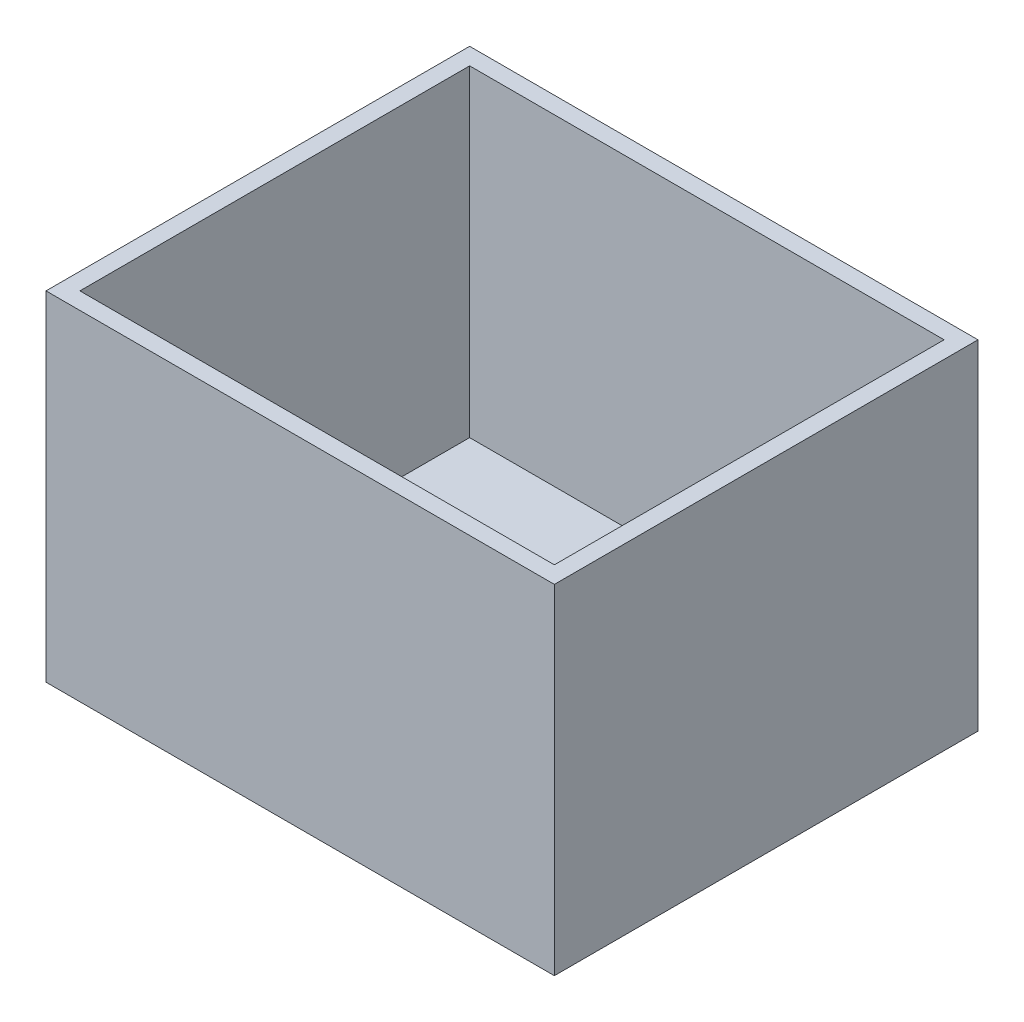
SolidWorks part; units mm, degrees
ref_plane "Plan de face" through (0, 0, 0) normal (0, 0, 1) x (1, 0, 0)
ref_plane "Plan de dessus" through (0, 0, 0) normal (0, 1, 0) x (1, 0, 0)
ref_plane "Plan de droite" through (0, 0, 0) normal (1, 0, 0) x (0, 0, -1)
sketch "Esquisse1" plane through (0, 0, 0) normal (0, 0, 1) x (1, 0, 0)
  line L1 (0, 0) -> (60, 0)
  line L2 (0, 0) -> (0, 40)
  line L3 (0, 40) -> (60, 40)
  line L4 (60, 0) -> (60, 40)
  dimension "D1" = 40
  dimension "D2" = 60
extrude "Boss.-Extru.1" add sketch "Esquisse1" along normal mid plane 50
sketch "Esquisse2" plane through (0, 0, 0) normal (0, -1, 0) x (1, 0, 0)
  line L0 (0, 0) -> (55, 0) construction
  line L1 (0, 25) -> (0, -25) construction
  circle A0 centre (6, 18) radius 2.5
  circle A1 centre (6, -18) radius 2.5
  circle A2 centre (55, 0) radius 2.5
  dimension "D1" = 5
  dimension "D2" = 18
  dimension "D3" = 36
  dimension "D4" = 6
  dimension "D5" = 55
sketch "Esquisse3" plane through (0, 40, 0) normal (0, 1, 0) x (1, 0, 0)
  line L0 (58, 23) -> (2, 23)
  line L1 (2, 23) -> (2, -23)
  line L2 (2, -23) -> (58, -23)
  line L3 (58, -23) -> (58, 23)
  line L4 (60, 25) -> (0, 25)
  line L5 (0, 25) -> (0, -25)
  line L6 (0, -25) -> (60, -25)
  line L7 (60, -25) -> (60, 25)
  line L8 (60, 25) -> (0, 25) construction
  line L9 (0, 25) -> (0, -25) construction
  line L10 (0, -25) -> (60, -25) construction
  line L11 (60, -25) -> (60, 25) construction
  dimension "D1" = 0
  dimension "D2" = 2
extrude "Enlèv. mat.-Extru.1" cut sketch "Esquisse3" against normal blind 38
sketch "Esquisse4" plane through (0, 0, 0) normal (0, 0, 1) x (1, 0, 0)
  line L0 (0, 40) -> (60, 0) construction
  line L1 (0, 0) -> (60, 40) construction
  point P8 (30, 20)
sketch "Esquisse5" plane through (0, 0, 0) normal (-1, 0, 0) x (0, 0, 1)
  line L0 (-25, 40) -> (25, 0) construction
  line L1 (-25, 40) -> (-25, 0) construction
  line L2 (25, 40) -> (-25, 40) construction
  point P7 (0, 20)
